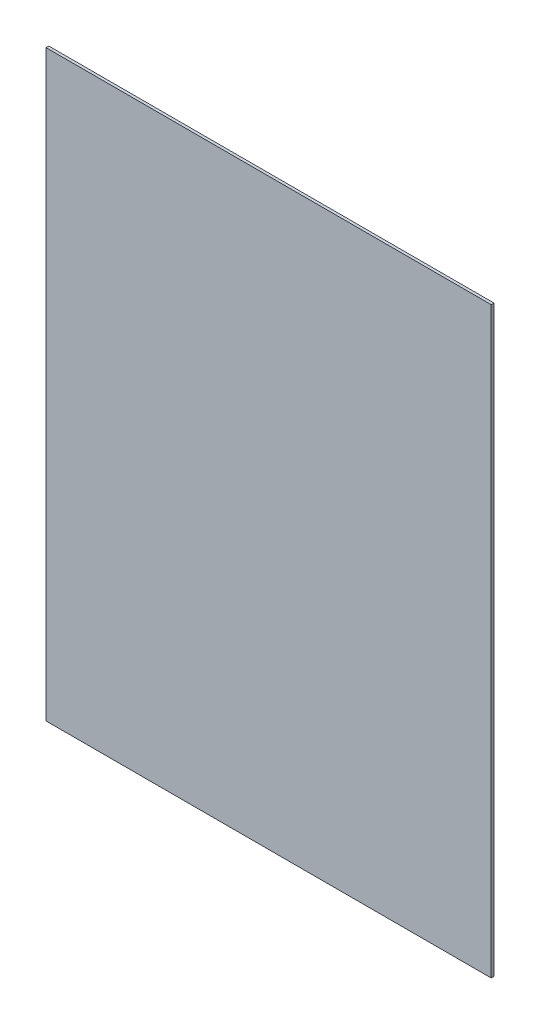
SolidWorks part; units mm, degrees
ref_plane "Alzado" through (0, 0, 0) normal (0, 0, 1) x (1, 0, 0)
ref_plane "Planta" through (0, 0, 0) normal (0, 1, 0) x (1, 0, 0)
ref_plane "Vista lateral" through (0, 0, 0) normal (1, 0, 0) x (0, 0, -1)
sketch "Sketch1" plane through (0, 0, 0) normal (0, 0, 1) x (1, 0, 0)
  line L1 (0, 0) -> (481, 0)
  line L2 (0, 0) -> (0, 630)
  line L3 (0, 630) -> (481, 630)
  line L4 (481, 0) -> (481, 630)
  dimension "D1" = 481
  dimension "D2" = 630
extrude "Boss-Extrude1" add sketch "Sketch1" along normal blind 3
